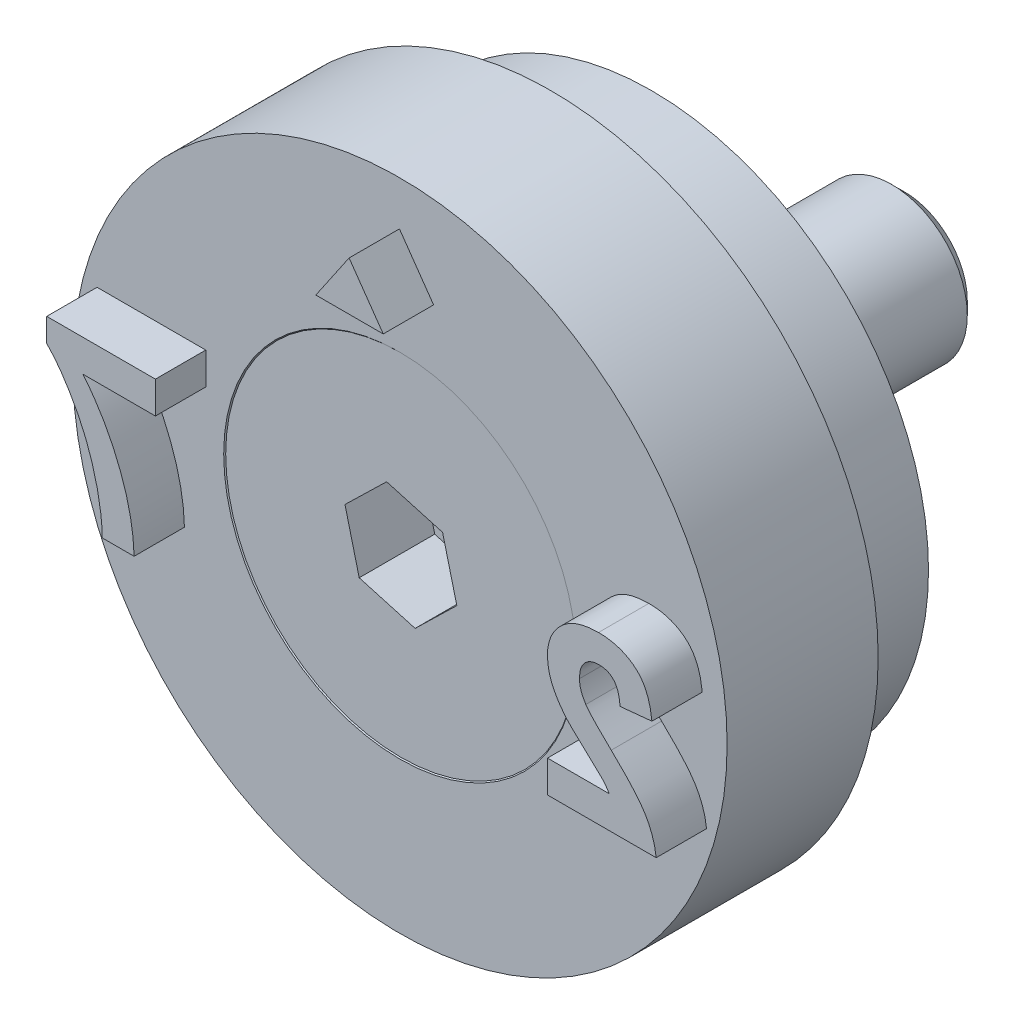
SolidWorks part; units mm, degrees
other "<M3 X .5 FHCS>-<Imported1>"
ref_plane "Front Plane" through (0, 0, 0) normal (0, 0, 1) x (1, 0, 0)
ref_plane "Top Plane" through (0, 0, 0) normal (0, 1, 0) x (1, 0, 0)
ref_plane "Right Plane" through (0, 0, 0) normal (1, 0, 0) x (0, 0, -1)
imported_body "Imported1"
other "DeleteFace1"
sketch "Sketch1" plane through (0, 0, 0) normal (0, 0, 1) x (1, 0, 0)
  line L0 (-0.0087, 5.6166) -> (-0.6694, 4.6482)
  line L1 (-0.6694, 4.6482) -> (0.6694, 4.6482)
  line L2 (0.6694, 4.6482) -> (-0.0087, 5.6166)
  text T0 "2      7" font "Arial" height 3.302
  dimension "D1" = 1.651
  dimension "D2" = 6.26
extrude "Boss-Extrude1" add sketch "Sketch1" along normal blind 1
inserted part "M3 X .5 FHCS"
move or copy body "Body-Move/Copy2" placed by mates yes
